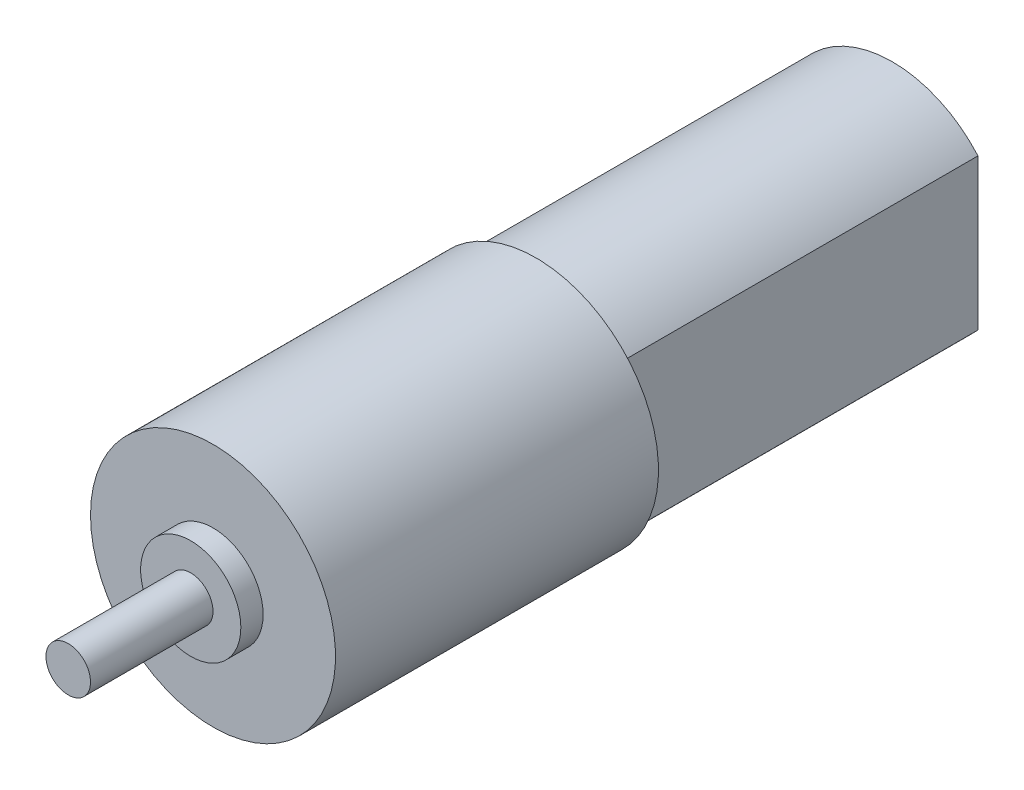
SolidWorks part; units mm, degrees
ref_plane "Plan de face" through (0, 0, 0) normal (0, 0, 1) x (1, 0, 0)
ref_plane "Plan de dessus" through (0, 0, 0) normal (0, 1, 0) x (1, 0, 0)
ref_plane "Plan de droite" through (0, 0, 0) normal (1, 0, 0) x (0, 0, -1)
sketch "Esquisse1" plane through (0, 0, 0) normal (0, 0, 1) x (1, 0, 0)
  circle A0 centre (0, 0) radius 11
  dimension "D1" = 22
extrude "Boss.-Extru.1" add sketch "Esquisse1" along normal blind 61
sketch "Esquisse2" plane through (0, 0, 61) normal (0, 0, 1) x (1, 0, 0)
  circle A0 centre (0, 0) radius 4.5
  dimension "D1" = 9
extrude "Boss.-Extru.2" add sketch "Esquisse2" along normal blind 2
sketch "Esquisse3" plane through (0, 0, 63) normal (0, 0, 1) x (1, 0, 0)
  circle A0 centre (0, 0) radius 2
  dimension "D1" = 4
extrude "Boss.-Extru.3" add sketch "Esquisse3" along normal blind 11
sketch "Esquisse6" plane through (0, 0, 0) normal (0, 0, -1) x (-1, 0, 0)
  line L1 (7.8062, 7.75) -> (17.0124, 7.75)
  line L2 (7.8062, 7.75) -> (7.8062, -7.75)
  line L3 (7.8062, -7.75) -> (17.0124, -7.75)
  line L4 (17.0124, 7.75) -> (17.0124, -7.75)
  line L5 (-7.6938, 7.8617) -> (-14.8365, 7.8617)
  line L6 (-7.6938, 7.8617) -> (-7.6938, -7.8617)
  line L7 (-7.6938, -7.8617) -> (-14.8365, -7.8617)
  line L8 (-14.8365, 7.8617) -> (-14.8365, -7.8617)
  circle A0 centre (0, 0) radius 11 construction
  circle A1 centre (0, 0) radius 11 construction
  dimension "D1" = 15.5
extrude "Enlèv. mat.-Extru.2" cut sketch "Esquisse6" against normal blind 32
sketch "Esquisse7" plane through (0, 0, 0) normal (0, 0, -1) x (-1, 0, 0)
  circle A0 centre (0, 0) radius 10.25
  dimension "D1" = 20.5
extrude "Enlèv. mat.-Extru.3" cut sketch "Esquisse7" against normal blind 32 flip side to cut
